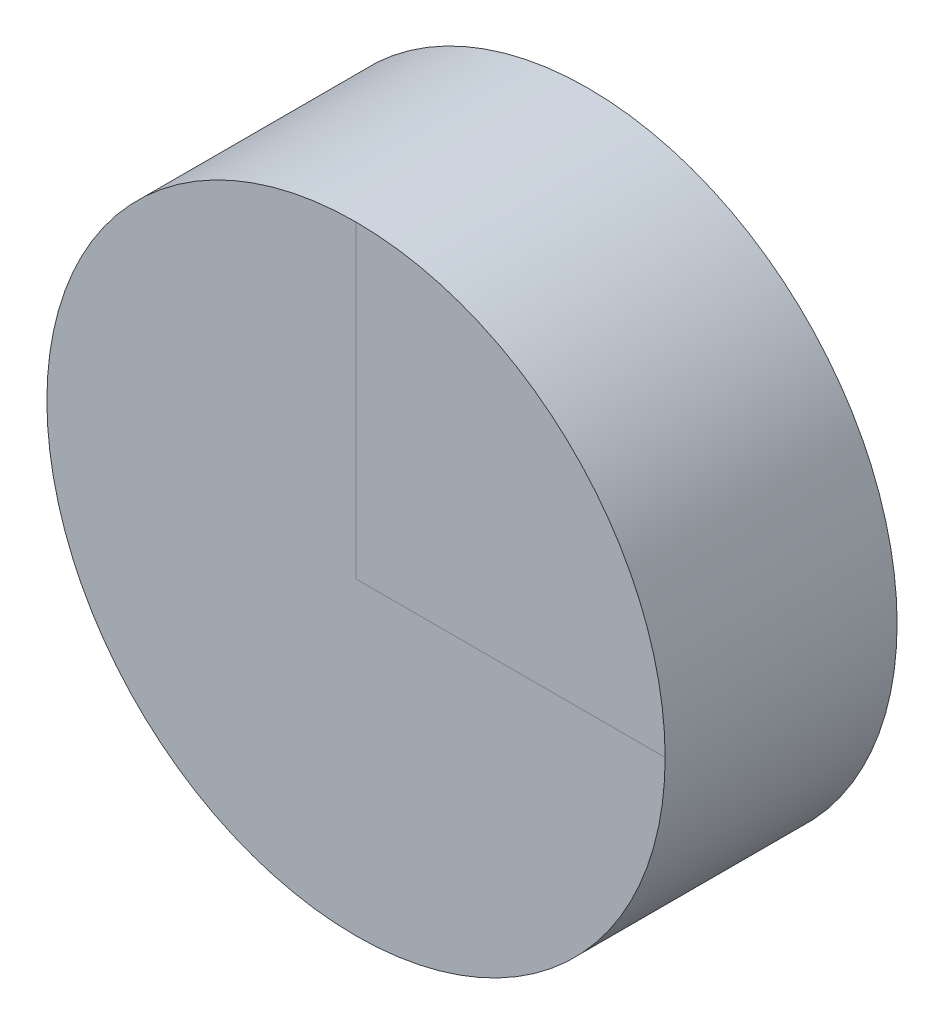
SolidWorks part; units mm, degrees
ref_plane "Front Plane" through (0, 0, 0) normal (0, 0, 1) x (1, 0, 0)
ref_plane "Top Plane" through (0, 0, 0) normal (0, 1, 0) x (1, 0, 0)
ref_plane "Right Plane" through (0, 0, 0) normal (1, 0, 0) x (0, 0, -1)
sketch "Sketch1" plane through (0, 0, 0) normal (0, 0, 1) x (1, 0, 0)
  circle A0 centre (0, 0) radius 200
  dimension "D1" = 400
extrude "Extrude1" add sketch "Sketch1" along normal blind 150.08
sketch "Sketch2" plane through (0, 0, 0) normal (0, 0, 1) x (1, 0, 0)
  line L0 (0, 0) -> (0, 200)
  line L1 (0, 0) -> (200, 0)
  circle A0 centre (0, 0) radius 200 construction
  arc A1 (200, 0) -> (0, 200) centre (0, 0) ccw
